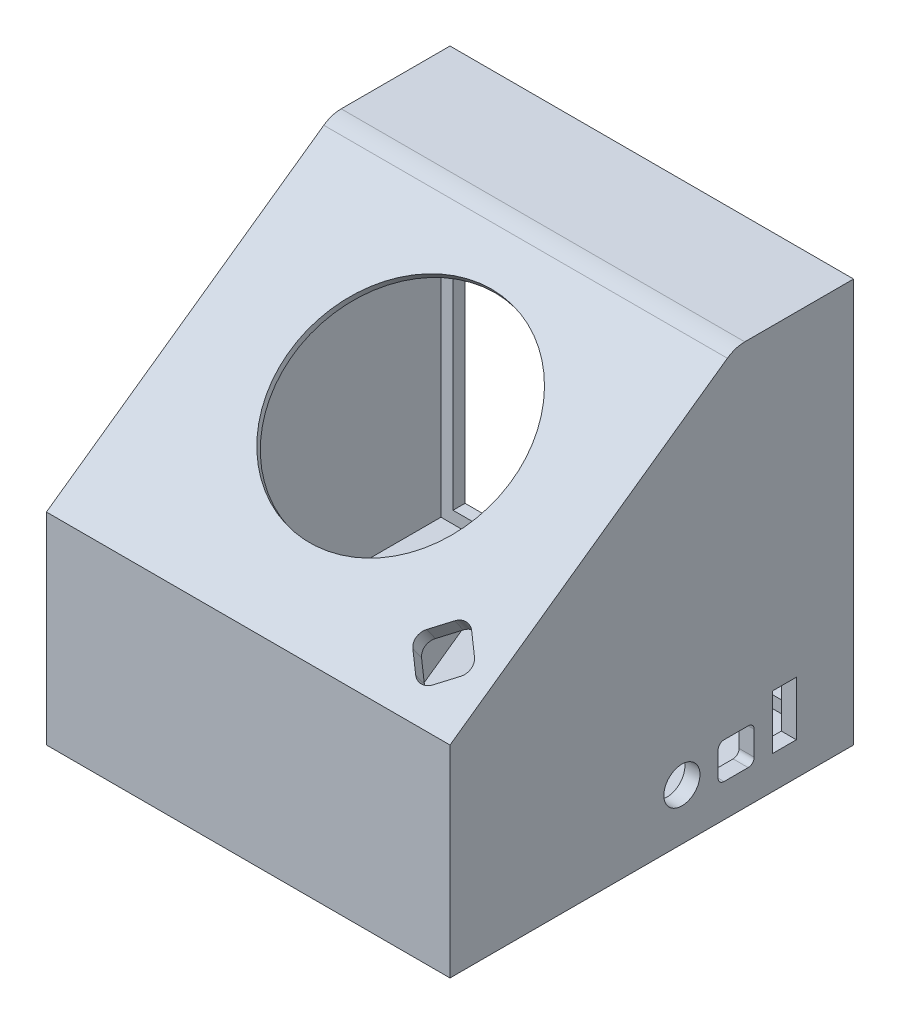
SolidWorks part; units mm, degrees
ref_plane "前视基准面" through (0, 0, 0) normal (0, 0, 1) x (1, 0, 0)
ref_plane "上视基准面" through (0, 0, 0) normal (0, 1, 0) x (1, 0, 0)
ref_plane "右视基准面" through (0, 0, 0) normal (1, 0, 0) x (0, 0, -1)
sketch "草图1" plane through (0, 0, 0) normal (0, 1, 0) x (1, 0, 0)
  line L1 (-34, 33) -> (33, 33)
  line L2 (-34, 33) -> (-34, -34)
  line L3 (-34, -34) -> (33, -34)
  line L4 (33, 33) -> (33, -34)
  dimension "D1" = 67
  dimension "D2" = 67
extrude "凸台-拉伸1" add sketch "草图1" along normal blind 67
ref_plane "基准面1" through (0, 2.5, 0) normal (0, 1, 0) x (1, 0, 0)
sketch "草图2" plane through (-34, 0, 0) normal (-1, 0, 0) x (0, 0, 1)
  line L0 (-33, 67) -> (34, 67) construction
  line L1 (-30.5, 64.5) -> (31.5, 64.5) construction
  line L2 (-30.5, 64.5) -> (-30.5, 2.5) construction
  line L3 (-30.5, 2.5) -> (31.5, 2.5) construction
  line L4 (31.5, 64.5) -> (31.5, 2.5) construction
  line L5 (-33, 67) -> (-33, 0) construction
  line L6 (34, 67) -> (34, 0) construction
  line L7 (-33, 0) -> (34, 0) construction
  line L8 (-13.3471, 67) -> (34, 33.5)
  line L9 (-13.3471, 67) -> (34, 67)
  line L10 (34, 67) -> (34, 33.5)
  dimension "D1" = 2.5
  dimension "D2" = 2.5
  dimension "D3" = 2.5
  dimension "D4" = 2.5
extrude "切除-拉伸1" cut sketch "草图2" against normal blind 67
shell "抽壳1" thickness 2.5
sketch "草图11" plane through (0, 38.3552, 27.1379) normal (0, 0.8163, 0.5776) x (1, 0, 0)
  line L0 (-34, 49.5939) -> (-34, -8.4061) construction
  line L1 (-31.5, 47.0939) -> (30.5, 47.0939)
  line L2 (-31.5, 47.0939) -> (-31.5, -5.9061)
  line L3 (-31.5, -5.9061) -> (30.5, -5.9061)
  line L4 (30.5, 47.0939) -> (30.5, -5.9061)
  line L5 (33, -8.4061) -> (-34, -8.4061) construction
  line L6 (33, 49.5939) -> (33, -8.4061) construction
  line L7 (33, 49.5939) -> (-34, 49.5939) construction
  line L10 (-19, 7.305) -> (-19, -5.4061)
  line L11 (-19, -5.4061) -> (18, -5.4061)
  line L12 (18, 7.305) -> (18, -5.4061)
  line L13 (-12, 3.8389) -> (-12, -5.4061)
  line L14 (-12, -5.4061) -> (13, -5.4061)
  line L15 (13, 5.223) -> (13, -5.4061)
  arc A0 (18, 7.305) -> (-19, 7.305) centre (-0.5, 22.5939) ccw
  arc A1 (13, 5.223) -> (-12, 3.8389) centre (-0.5, 22.5939) ccw
  circle A2 centre (-0.5, 22.5939) radius 18.5
  point P4 (-34, 20.5939)
  dimension "D5" = 48
  dimension "D11" = 44
  dimension "D12" = 37
  dimension "D1" = 2.5
  dimension "D2" = 2.5
  dimension "D3" = 2.5
  dimension "D4" = 2.5
  dimension "D6" = 25
  dimension "D7" = 22
  dimension "D8" = 55
  dimension "D9" = 37
  dimension "D10" = 15
sketch "草图13" plane through (0, 31.9879, 22.6327) normal (0, -0.8163, -0.5776) x (1, 0, 0)
  line L0 (-19, -7.305) -> (-19, 5.4061) construction
  line L1 (-19, 5.4061) -> (18, 5.4061) construction
  line L2 (18, -7.305) -> (18, 5.4061) construction
  line L3 (-19, -7.305) -> (-19, 5.4061)
  line L4 (-31.5, 10.8624) -> (-31.5, -56.2897)
  line L5 (-31.5, -56.2897) -> (30.5, -56.2897)
  line L6 (30.5, -56.2897) -> (30.5, 10.8624)
  line L7 (30.5, 10.8624) -> (-31.5, 10.8624)
  line L8 (-31.5, 10.8624) -> (-31.5, -56.2897) construction
  line L9 (-31.5, -56.2897) -> (30.5, -56.2897) construction
  line L10 (30.5, -56.2897) -> (30.5, 10.8624) construction
  line L11 (30.5, 10.8624) -> (-31.5, 10.8624) construction
  line L12 (-19, 5.4061) -> (18, 5.4061)
  line L13 (18, -7.305) -> (18, 5.4061)
  arc A0 (-19, -7.305) -> (18, -7.305) centre (-0.5, -22.5939) ccw construction
  arc A1 (-19, -7.305) -> (18, -7.305) centre (-0.5, -22.5939) ccw
  dimension "D1" = 0
extrude "切除-拉伸2" cut sketch "草图13" against normal blind 2.3
sketch "草图14" plane through (0, 33.8654, 23.9611) normal (0, -0.8163, -0.5776) x (1, 0, 0)
  line L0 (-12, -3.8389) -> (-12, 5.4061) construction
  line L1 (13, -5.223) -> (13, 5.4061) construction
  line L2 (-12, -3.8389) -> (-12, 5.4061)
  line L3 (18, -7.305) -> (18, 5.4061)
  line L4 (18, 5.4061) -> (-19, 5.4061)
  line L5 (-19, 5.4061) -> (-19, -7.305)
  line L6 (18, -7.305) -> (18, 5.4061) construction
  line L7 (18, 5.4061) -> (-19, 5.4061) construction
  line L8 (-19, 5.4061) -> (-19, -7.305) construction
  line L9 (13, -5.223) -> (13, 5.4061)
  line L10 (-12, 5.4061) -> (13, 5.4061)
  arc A0 (-12, -3.8389) -> (13, -5.223) centre (-0.5, -22.5939) ccw construction
  arc A1 (-19, -7.305) -> (18, -7.305) centre (-0.5, -22.5939) ccw
  arc A2 (-19, -7.305) -> (18, -7.305) centre (-0.5, -22.5939) ccw construction
  arc A3 (-12, -3.8389) -> (13, -5.223) centre (-0.5, -22.5939) ccw
  dimension "D1" = 0
extrude "切除-拉伸3" cut sketch "草图14" against normal blind 4.5
sketch "草图15" plane through (0, 37.5389, 26.5603) normal (0, -0.8163, -0.5776) x (1, 0, 0)
  line L3 (13, -5.223) -> (13, 5.4061)
  line L4 (13, 5.4061) -> (-12, 5.4061)
  line L5 (-12, 5.4061) -> (-12, -3.8389)
  line L6 (13, -5.223) -> (13, 5.4061) construction
  line L7 (13, 5.4061) -> (-12, 5.4061) construction
  line L8 (-12, 5.4061) -> (-12, -3.8389) construction
  circle A0 centre (-0.5, -22.5939) radius 18.5 construction
  arc A1 (-12, -3.8389) -> (13, -5.223) centre (-0.5, -22.5939) ccw
  arc A2 (-12, -3.8389) -> (13, -5.223) centre (-0.5, -22.5939) ccw construction
  circle A3 centre (-0.5, -22.5939) radius 18.5
  dimension "D1" = 0
extrude "切除-拉伸4" cut sketch "草图15" against normal blind 1
sketch "草图20" plane through (0, 38.3552, 27.1379) normal (0, 0.8163, 0.5776) x (1, 0, 0)
  line L6 (24.5, 6.0939) -> (29.874, 0.7199)
  line L7 (29.874, 0.7199) -> (24.5, -4.6541)
  line L8 (24.5, -4.6541) -> (19.126, 0.7199)
  line L9 (19.126, 0.7199) -> (24.5, 6.0939)
  dimension "D1" = 7.6
  dimension "D2" = 7.6
sketch "草图21" plane through (0, 31.9879, 22.6327) normal (0, -0.8163, -0.5776) x (1, 0, 0)
  line L0 (19.126, -0.7199) -> (19.126, 5.9061)
  line L1 (-31.5, 5.9061) -> (30.5, 5.9061) construction
  line L2 (19.126, 5.9061) -> (30.5, 5.9061)
  line L3 (24.5, -6.0939) -> (30.5, -6.0939)
  line L4 (30.5, -47.0939) -> (30.5, 5.9061) construction
  line L5 (30.5, -6.0939) -> (30.5, 5.9061)
  line L6 (24.5, -6.0939) -> (19.126, -6.0939)
  line L7 (19.126, -6.0939) -> (19.126, -0.7199)
extrude "切除-拉伸6" cut sketch "草图21" against normal blind 5.3
extrude "切除-拉伸7" cut sketch "草图20" against normal blind 2.5
sketch "草图22" plane through (30.5, 0, 0) normal (-1, 0, 0) x (0, 0, 1)
  line L2 (-16.5, 11.5) -> (-10.5, 11.5)
  line L3 (-16.5, 11.5) -> (-16.5, 5.5)
  line L4 (-16.5, 5.5) -> (-10.5, 5.5)
  line L5 (-10.5, 11.5) -> (-10.5, 5.5)
  line L6 (-23.5, 14.5) -> (-19.5, 14.5)
  line L7 (-23.5, 14.5) -> (-23.5, 5.5)
  line L8 (-23.5, 5.5) -> (-19.5, 5.5)
  line L9 (-23.3182, 64.5) -> (-33, 64.5)
  line L10 (-33, 64.5) -> (-33, 2.5)
  line L11 (-33, 2.5) -> (31.5, 2.5)
  line L12 (31.5, 2.5) -> (31.5, 25.7139)
  line L13 (31.5, 25.7139) -> (27.454, 28.5766)
  line L14 (27.454, 28.5766) -> (30.5152, 32.9031)
  line L15 (30.5152, 32.9031) -> (20.7193, 39.8342)
  line L16 (20.7193, 39.8342) -> (17.658, 35.5076)
  line L17 (17.658, 35.5076) -> (-23.3182, 64.5)
  line L18 (-23.3182, 64.5) -> (-33, 64.5) construction
  line L19 (-33, 64.5) -> (-33, 2.5) construction
  line L20 (-33, 2.5) -> (31.5, 2.5) construction
  line L21 (31.5, 2.5) -> (31.5, 25.7139) construction
  line L22 (31.5, 25.7139) -> (27.454, 28.5766) construction
  line L23 (27.454, 28.5766) -> (30.5152, 32.9031) construction
  line L24 (30.5152, 32.9031) -> (20.7193, 39.8342) construction
  line L25 (20.7193, 39.8342) -> (17.658, 35.5076) construction
  line L26 (17.658, 35.5076) -> (-23.3182, 64.5) construction
  line L27 (-19.5, 14.5) -> (-19.5, 5.5)
  circle A0 centre (-4.5, 8.5) radius 3
  dimension "D2" = 6
  dimension "D3" = 36
  dimension "D4" = 6
  dimension "D5" = 6
  dimension "D6" = 6
  dimension "D7" = 42
  dimension "D8" = 3
  dimension "D9" = 4
  dimension "D10" = 9
  dimension "D11" = 51
  dimension "D12" = 12
  dimension "D1" = 0
extrude "切除-拉伸9" cut sketch "草图22" against normal blind 2.5
sketch "草图25" plane through (30.5, 0, 0) normal (-1, 0, 0) x (0, 0, 1)
  line L1 (-31, 64.5) -> (-29, 64.5)
  line L2 (-31, 64.5) -> (-31, 2.5)
  line L3 (-31, 2.5) -> (-29, 2.5)
  line L4 (-29, 64.5) -> (-29, 2.5)
  line L9 (-23.3182, 64.5) -> (-33, 64.5)
  line L10 (-33, 64.5) -> (-33, 2.5)
  line L11 (-33, 2.5) -> (31.5, 2.5)
  line L12 (31.5, 2.5) -> (31.5, 25.7139)
  line L13 (31.5, 25.7139) -> (27.454, 28.5766)
  line L14 (27.454, 28.5766) -> (30.5152, 32.9031)
  line L15 (30.5152, 32.9031) -> (20.7193, 39.8342)
  line L16 (20.7193, 39.8342) -> (17.658, 35.5076)
  line L17 (17.658, 35.5076) -> (-23.3182, 64.5)
  line L18 (-23.3182, 64.5) -> (-33, 64.5) construction
  line L19 (-33, 64.5) -> (-33, 2.5) construction
  line L20 (-33, 2.5) -> (31.5, 2.5) construction
  line L21 (31.5, 2.5) -> (31.5, 25.7139) construction
  line L22 (31.5, 25.7139) -> (27.454, 28.5766) construction
  line L23 (27.454, 28.5766) -> (30.5152, 32.9031) construction
  line L24 (30.5152, 32.9031) -> (20.7193, 39.8342) construction
  line L25 (20.7193, 39.8342) -> (17.658, 35.5076) construction
  line L26 (17.658, 35.5076) -> (-23.3182, 64.5) construction
  dimension "D2" = 2
  dimension "D3" = 2
  dimension "D1" = 0
extrude "凸台-拉伸4" add sketch "草图25" along normal blind 62
sketch "草图27" plane through (0, 0, -31) normal (0, 0, -1) x (-1, 0, 0)
  line L0 (-30.5, 64.5) -> (-30.5, 2.5) construction
  line L1 (-28.5, 63.556) -> (29.5, 63.556)
  line L2 (-28.5, 63.556) -> (-28.5, 4.5)
  line L3 (-28.5, 4.5) -> (29.5, 4.5)
  line L4 (29.5, 63.556) -> (29.5, 4.5)
  line L5 (31.5, 65.556) -> (-30.5, 65.556) construction
  line L6 (31.5, 65.556) -> (31.5, 34.944) construction
  line L7 (36.85, 2.5) -> (-36.85, 2.5) construction
  dimension "D1" = 2
  dimension "D2" = 2
  dimension "D3" = 2
  dimension "D4" = 2
extrude "切除-拉伸10" cut sketch "草图27" against normal blind 2
sketch "草图28" plane through (-31.5, 0, 0) normal (1, 0, 0) x (0, 0, -1)
  line L5 (-31.5, 2.5) -> (29, 2.5)
  line L6 (29, 2.5) -> (29, 64.5)
  line L7 (29, 64.5) -> (23.3182, 64.5)
  line L8 (23.3182, 64.5) -> (-31.5, 25.7139)
  line L9 (-31.5, 25.7139) -> (-31.5, 2.5)
  line L10 (-31.5, 2.5) -> (29, 2.5) construction
  line L11 (29, 2.5) -> (29, 64.5) construction
  line L12 (29, 64.5) -> (23.3182, 64.5)
  line L13 (23.3182, 64.5) -> (-31.5, 25.7139) construction
  line L14 (-31.5, 25.7139) -> (-31.5, 2.5) construction
  dimension "D1" = 0
fillet "圆角1" radius 5 1 edges at (-0.5, 67, -13.3471)
fillet "圆角2" radius 1 4 edges at (31.75, 5.5, -16.5) (31.75, 5.5, -10.5) (31.75, 11.5, -10.5) (31.75, 11.5, -16.5)
fillet "圆角3" radius 2 4 edges at (29.874, 37.7506, 25.8282) (24.5, 34.6467, 30.2152) (19.126, 37.7506, 25.8282) (24.5, 40.8546, 21.4412)
sketch "草图29" plane through (-31.5, 0, 0) normal (1, 0, 0) x (0, 0, -1)
  line L1 (-25.8, 9.5) -> (-16.3, 9.5)
  line L2 (-25.8, 9.5) -> (-25.8, 5.5)
  line L3 (-25.8, 5.5) -> (-16.3, 5.5)
  line L4 (-16.3, 9.5) -> (-16.3, 5.5)
  line L5 (-31.5, 2.5) -> (29, 2.5)
  line L6 (29, 2.5) -> (29, 64.5)
  line L7 (29, 64.5) -> (23.3182, 64.5)
  line L8 (23.3182, 64.5) -> (-31.5, 25.7139)
  line L9 (-31.5, 25.7139) -> (-31.5, 2.5)
  line L10 (-31.5, 2.5) -> (29, 2.5) construction
  line L11 (29, 2.5) -> (29, 64.5) construction
  line L12 (29, 64.5) -> (23.3182, 64.5) construction
  line L13 (23.3182, 64.5) -> (-31.5, 25.7139) construction
  line L14 (-31.5, 25.7139) -> (-31.5, 2.5) construction
  dimension "D2" = 9.5
  dimension "D3" = 4
  dimension "D4" = 3
  dimension "D5" = 15.2
  dimension "D1" = 0
extrude "切除-拉伸12" cut sketch "草图29" against normal blind 2.5
